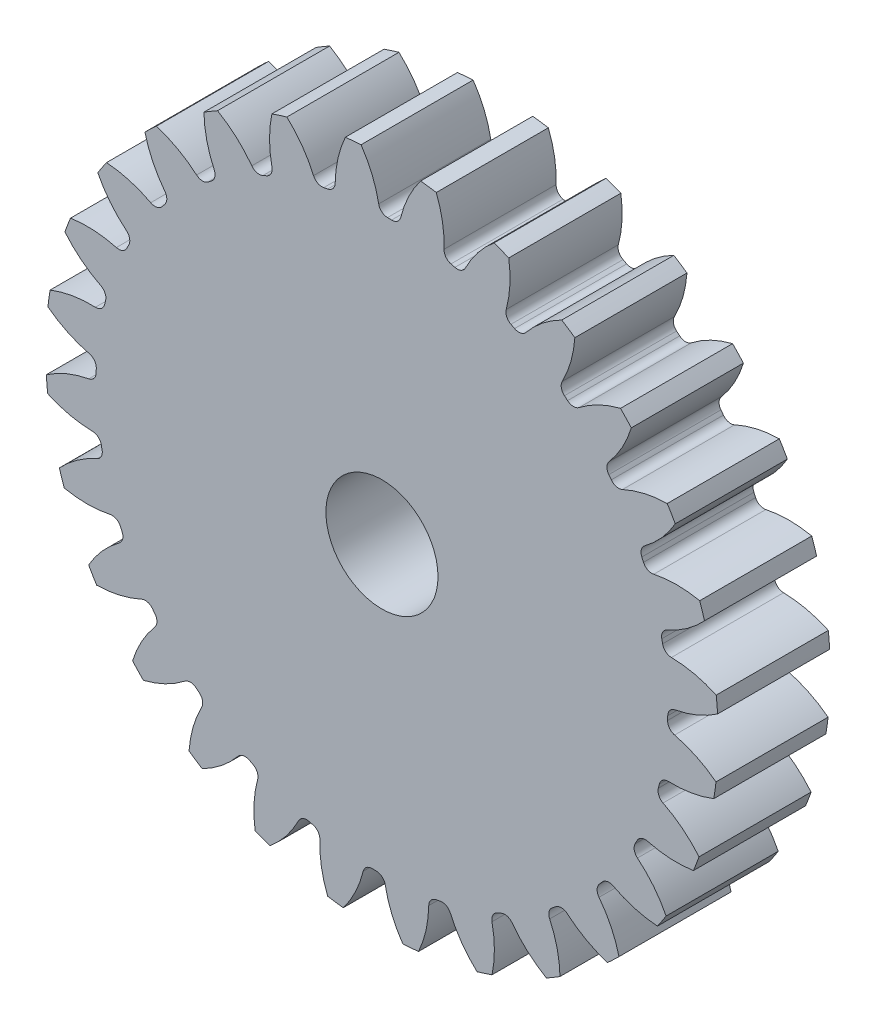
SolidWorks part; units mm, degrees
ref_plane "Front" through (0, 0, 0) normal (0, 0, 1) x (1, 0, 0)
ref_plane "Top" through (0, 0, 0) normal (0, 1, 0) x (1, 0, 0)
ref_plane "Right" through (0, 0, 0) normal (1, 0, 0) x (0, 0, -1)
sketch "Sketch3" plane through (0, 0, 0) normal (0, 0, 1) x (1, 0, 0)
  circle A0 centre (0, 0) radius 304.8
  dimension "od" = 609.6
extrude "gearBody" add sketch "Sketch3" along normal blind 101.6
sketch "Sketch2" plane through (0, 0, 0) normal (0, 0, 1) x (1, 0, 0)
  line L0 (0, 0) -> (246.9749, 102.3004) construction
  line L1 (303.3427, -35.5081) -> (0, 0) construction
  line L2 (0, 0) -> (36.3143, 0) construction
  line L3 (284.3574, 8.3516) -> (283.513, -23.4359) construction
  line L5 (283.9352, -7.5421) -> (0, 0) construction
  line L7 (0, 0) -> (267.3238, 0) construction
  arc A0 (267.304, 3.2522) -> (266.7544, -17.4383) centre (0, 0) ccw construction
  arc A1 (304.2106, 18.9463) -> (302.7758, -35.0696) centre (0, 0) ccw construction
  arc A2 (284.3574, 8.3516) -> (283.513, -23.4359) centre (0, 0) ccw construction
  arc A3 (258.9325, -8.741) -> (259.0314, -5.0176) centre (0, 0) ccw
  arc A4 (303.3427, -35.5081) -> (265.2321, -17.0532) centre (241.1957, -115.2676) ccw
  arc A5 (303.3427, -35.5081) -> (304.8, 19.3541) centre (0, 0) ccw
  arc A6 (304.8, 19.3541) -> (265.7634, 2.9484) centre (246.9749, 102.3004) cw
  arc A7 (259.0314, -5.0176) -> (265.7634, 2.9484) centre (267.3001, -5.1778) cw
  arc A8 (265.2321, -17.0532) -> (258.9325, -8.741) centre (267.198, -9.02) cw
  point P6 (304.8, 19.3541)
  point P22 (303.3427, -35.5081)
  dimension "baseDia" = 534.6475
  dimension "od" = 609.6
  dimension "pd" = 568.96
  dimension "rd" = 518.16
  dimension "rFillet" = 8.2702
  dimension "pointX" = 304.8
  dimension "pointY" = 19.3541
  dimension "CTT" = 31.7875
  dimension "flankCenterAngle" = 22.5
extrude "toothCut" cut sketch "Sketch2" along normal through all
pattern_circular "CirPattern1" count 28 over 360 about axis through (0, 0, 0) along (0, 0, 1) of "toothCut"
sketch "hub1Dia" plane through (0, 0, 0) normal (0, 0, -1) x (-1, 0, 0)
  circle A0 centre (0, 0) radius 12.7
  dimension "hub1Dia" = 25.4
sketch "hub2Dia" plane through (0, 0, 101.6) normal (0, 0, 1) x (1, 0, 0)
  circle A0 centre (0, 0) radius 12.7
  dimension "hub2dia" = 25.4
sketch "boreDia" plane through (0, 0, 0) normal (0, 0, 1) x (1, 0, 0)
  circle A0 centre (0, 0) radius 50.8
  dimension "boreDia" = 101.6
extrude "bore" cut sketch "boreDia" against normal mid plane 25400
